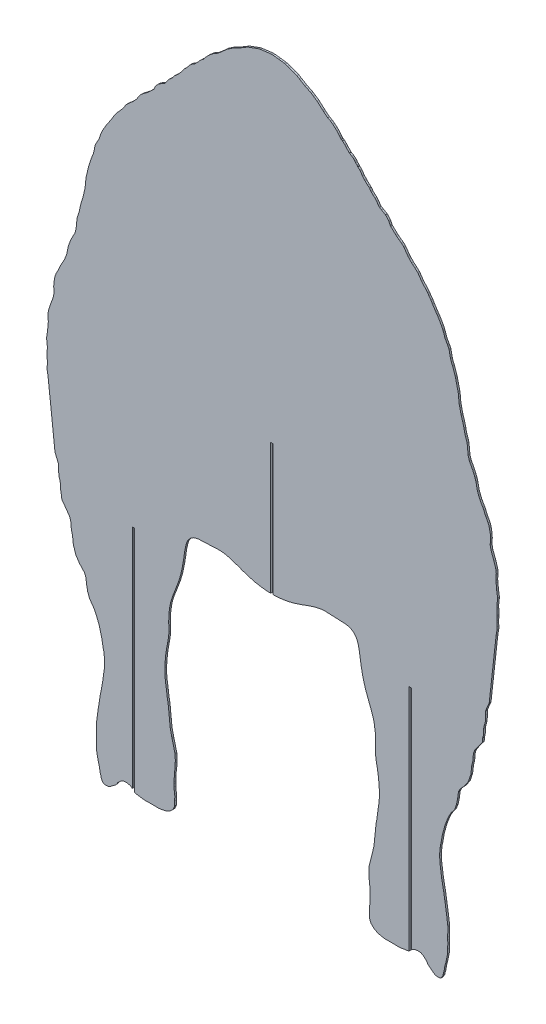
SolidWorks part; units mm, degrees
ref_plane "Спереди" through (0, 0, 0) normal (0, 0, 1) x (1, 0, 0)
ref_plane "Сверху" through (0, 0, 0) normal (0, 1, 0) x (1, 0, 0)
ref_plane "Справа" through (0, 0, 0) normal (1, 0, 0) x (0, 0, -1)
sketch "Model" plane through (0, 0, 0) normal (0, 0, 1) x (1, 0, 0)
  line L0 (-5496.2445, 189.9029) -> (-5495.9096, 189.4966)
  line L1 (-5495.9096, 189.4966) -> (-5494.3551, 186.1631)
  line L2 (-5494.3551, 186.1631) -> (-5493.4235, 179.621)
  line L3 (-5493.4235, 179.621) -> (-5493.4364, 179.0282)
  line L4 (-5493.4364, 179.0282) -> (-5492.0028, 172.1316)
  line L5 (-5492.0028, 172.1316) -> (-5491.8416, 171.8408)
  line L6 (-5491.8416, 171.8408) -> (-5491.6804, 171.5499)
  line L7 (-5491.6804, 171.5499) -> (-5490.0743, 166.7919)
  line L8 (-5490.0743, 166.7919) -> (-5489.6801, 166.2414)
  line L9 (-5489.6801, 166.2414) -> (-5489.4588, 165.9892)
  line L10 (-5489.4588, 165.9892) -> (-5489.2374, 165.737)
  line L11 (-5489.2374, 165.737) -> (-5486.8596, 162.5707)
  line L12 (-5486.8596, 162.5707) -> (-5486.5667, 162.237)
  line L13 (-5486.5667, 162.237) -> (-5486.2738, 161.9033)
  line L14 (-5486.2738, 161.9033) -> (-5484.7952, 159.28)
  line L15 (-5484.7952, 159.28) -> (-5483.6149, 157.1755)
  line L16 (-5483.6149, 157.1755) -> (-5481.8233, 152.959)
  line L17 (-5481.8233, 152.959) -> (-5481.7658, 152.7644)
  line L18 (-5481.7658, 152.7644) -> (-5481.7082, 152.5696)
  line L19 (-5481.7082, 152.5696) -> (-5480.7843, 150.3208)
  line L20 (-5480.7843, 150.3208) -> (-5480.0863, 148.4638)
  line L21 (-5480.0863, 148.4638) -> (-5479.4524, 147.0466)
  line L22 (-5479.4524, 147.0466) -> (-5479.2418, 146.1877)
  line L23 (-5479.2418, 146.1877) -> (-5476.2774, 135.1042)
  line L24 (-5476.2774, 135.1042) -> (-5474.7989, 126.6455)
  line L25 (-5474.7989, 126.6455) -> (-5474.1593, 124.0295)
  line L26 (-5474.1593, 124.0295) -> (-5473.7948, 121.4179)
  line L27 (-5473.7948, 121.4179) -> (-5473.392, 116.9064)
  line L28 (-5473.392, 116.9064) -> (-5473.1167, 113.4783)
  line L29 (-5473.1167, 113.4783) -> (-5473.4549, 109.7988)
  line L30 (-5473.4549, 109.7988) -> (-5473.5587, 106.9177)
  line L31 (-5473.5587, 106.9177) -> (-5474.4143, 100.9123)
  line L32 (-5474.4143, 100.9123) -> (-5475.4951, 92.9453)
  line L33 (-5475.4951, 92.9453) -> (-5476.1924, 89.4713)
  line L34 (-5476.1924, 89.4713) -> (-5477.0354, 84.4822)
  line L35 (-5477.0354, 84.4822) -> (-5477.8445, 80.8982)
  line L36 (-5477.8445, 80.8982) -> (-5479.0215, 73.1225)
  line L37 (-5479.0215, 73.1225) -> (-5479.2856, 71.7514)
  line L38 (-5479.2856, 71.7514) -> (-5480.7816, 62.0454)
  line L39 (-5480.7816, 62.0454) -> (-5482.3022, 50.7461)
  line L40 (-5482.3022, 50.7461) -> (-5482.335, 50.2573)
  line L41 (-5482.335, 50.2573) -> (-5482.3678, 49.7685)
  line L42 (-5482.3678, 49.7685) -> (-5482.3807, 48.9289)
  line L43 (-5482.3807, 48.9289) -> (-5482.2994, 39.0254)
  line L44 (-5482.2994, 39.0254) -> (-5482.2846, 36.1582)
  line L45 (-5482.2846, 36.1582) -> (-5482.418, 32.8984)
  line L46 (-5482.418, 32.8984) -> (-5482.1374, 27.2427)
  line L47 (-5482.1374, 27.2427) -> (-5482.1283, 22.9883)
  line L48 (-5482.1283, 22.9883) -> (-5480.2995, 14.143)
  line L49 (-5480.2995, 14.143) -> (-5480.0821, 13.1252)
  line L50 (-5480.0821, 13.1252) -> (-5480.0126, 12.9504)
  line L51 (-5480.0126, 12.9504) -> (-5479.943, 12.7754)
  line L52 (-5479.943, 12.7754) -> (-5479.8217, 12.2882)
  line L53 (-5479.8217, 12.2882) -> (-5479.7004, 11.801)
  line L54 (-5479.7004, 11.801) -> (-5478.7688, 8.2534)
  line L55 (-5478.7688, 8.2534) -> (-5478.5633, 5.9324)
  line L56 (-5478.5633, 5.9324) -> (-5478.0259, 3.5652)
  line L57 (-5478.0259, 3.5652) -> (-5477.6842, 2.6575)
  line L58 (-5477.6842, 2.6575) -> (-5477.1875, 0.3865)
  line L59 (-5477.1875, 0.3865) -> (-5476.9723, -0.7583)
  line L60 (-5476.9723, -0.7583) -> (-5475.4734, -3.2901)
  line L61 (-5475.4734, -3.2901) -> (-5475.135, -4.0174)
  line L62 (-5475.135, -4.0174) -> (-5474.6471, -4.3303)
  line L63 (-5474.6471, -4.3303) -> (-5472.6105, -5.0435)
  line L64 (-5472.6105, -5.0435) -> (-5470.0517, -4.833)
  line L65 (-5470.0517, -4.833) -> (-5468.8631, -4.739)
  line L66 (-5468.8631, -4.739) -> (-5467.9083, -4.3711)
  line L67 (-5467.9083, -4.3711) -> (-5464.1485, -1.6074)
  line L68 (-5464.1485, -1.6074) -> (-5460.7275, 1.0117)
  line L69 (-5460.7275, 1.0117) -> (-5460.0107, 1.8904)
  line L70 (-5460.0107, 1.8904) -> (-5458.4354, 4.2187)
  line L71 (-5458.4354, 4.2187) -> (-5458.1438, 4.6213)
  line L72 (-5458.1438, 4.6213) -> (-5454.8446, 7.6282)
  line L73 (-5454.8446, 7.6282) -> (-5453.4923, 8.2492)
  line L74 (-5453.4923, 8.2492) -> (-5452.1635, 8.935)
  line L75 (-5452.1635, 8.935) -> (-5449.5111, 9.2304)
  line L76 (-5449.5111, 9.2304) -> (-5449.0866, 9.2051)
  line L77 (-5449.0866, 9.2051) -> (-5448.6621, 9.1794)
  line L78 (-5448.6621, 9.1794) -> (-5448.5307, 9.1855)
  line L79 (-5448.5307, 9.1855) -> (-5448.3992, 9.1916)
  line L80 (-5448.3992, 9.1916) -> (-5447.2, 8.9678)
  line L81 (-5447.2, 8.9678) -> (-5445.5066, 8.6291)
  line L82 (-5445.5066, 8.6291) -> (-5444.0579, 8.3113)
  line L83 (-5444.0579, 8.3113) -> (-5442.2299, 6.7488)
  line L84 (-5442.2299, 6.7488) -> (-5442.2299, 260.5305)
  line L85 (-5442.2299, 260.5305) -> (-5441.9799, 260.5305)
  line L86 (-5441.9799, 260.5305) -> (-5439.9799, 260.5305)
  line L87 (-5439.9799, 260.5305) -> (-5439.7299, 260.5305)
  line L88 (-5439.7299, 260.5305) -> (-5439.7299, 4.612)
  line L89 (-5439.7299, 4.612) -> (-5438.7787, 3.7991)
  line L90 (-5438.7787, 3.7991) -> (-5434.6053, 3.1968)
  line L91 (-5434.6053, 3.1968) -> (-5430.5375, 2.5481)
  line L92 (-5430.5375, 2.5481) -> (-5427.125, 2.2878)
  line L93 (-5427.125, 2.2878) -> (-5418.6017, 2.4498)
  line L94 (-5418.6017, 2.4498) -> (-5418.4295, 2.4263)
  line L95 (-5418.4295, 2.4263) -> (-5418.2572, 2.4028)
  line L96 (-5418.2572, 2.4028) -> (-5418.0674, 2.3752)
  line L97 (-5418.0674, 2.3752) -> (-5417.8775, 2.3476)
  line L98 (-5417.8775, 2.3476) -> (-5414.0434, 2.4126)
  line L99 (-5414.0434, 2.4126) -> (-5413.2241, 2.2605)
  line L100 (-5413.2241, 2.2605) -> (-5409.9278, 2.5803)
  line L101 (-5409.9278, 2.5803) -> (-5404.4787, 3.842)
  line L102 (-5404.4787, 3.842) -> (-5404.2971, 3.862)
  line L103 (-5404.2971, 3.862) -> (-5404.1256, 3.9563)
  line L104 (-5404.1256, 3.9563) -> (-5403.9541, 4.0503)
  line L105 (-5403.9541, 4.0503) -> (-5400.4633, 5.7129)
  line L106 (-5400.4633, 5.7129) -> (-5399.5392, 6.4496)
  line L107 (-5399.5392, 6.4496) -> (-5396.795, 9.0265)
  line L108 (-5396.795, 9.0265) -> (-5396.635, 9.2409)
  line L109 (-5396.635, 9.2409) -> (-5396.475, 9.4553)
  line L110 (-5396.475, 9.4553) -> (-5395.3647, 11.9946)
  line L111 (-5395.3647, 11.9946) -> (-5394.8888, 13.2324)
  line L112 (-5394.8888, 13.2324) -> (-5394.7879, 18.3425)
  line L113 (-5394.7879, 18.3425) -> (-5394.5776, 22.6931)
  line L114 (-5394.5776, 22.6931) -> (-5394.7191, 24.8401)
  line L115 (-5394.7191, 24.8401) -> (-5395.2345, 28.1706)
  line L116 (-5395.2345, 28.1706) -> (-5395.3371, 31.6555)
  line L117 (-5395.3371, 31.6555) -> (-5395.4515, 34.6379)
  line L118 (-5395.4515, 34.6379) -> (-5395.3511, 36.647)
  line L119 (-5395.3511, 36.647) -> (-5395.2123, 40.7546)
  line L120 (-5395.2123, 40.7546) -> (-5395.0561, 42.5802)
  line L121 (-5395.0561, 42.5802) -> (-5395.03, 45.147)
  line L122 (-5395.03, 45.147) -> (-5394.4729, 49.5852)
  line L123 (-5394.4729, 49.5852) -> (-5394.1224, 55.52)
  line L124 (-5394.1224, 55.52) -> (-5394.0329, 58.1006)
  line L125 (-5394.0329, 58.1006) -> (-5394.3614, 63.8605)
  line L126 (-5394.3614, 63.8605) -> (-5394.4182, 64.4795)
  line L127 (-5394.4182, 64.4795) -> (-5394.5711, 65.0762)
  line L128 (-5394.5711, 65.0762) -> (-5397.6181, 77.3454)
  line L129 (-5397.6181, 77.3454) -> (-5397.8001, 77.905)
  line L130 (-5397.8001, 77.905) -> (-5398.0493, 79.0061)
  line L131 (-5398.0493, 79.0061) -> (-5399.6808, 86.3602)
  line L132 (-5399.6808, 86.3602) -> (-5400.5667, 94.6023)
  line L133 (-5400.5667, 94.6023) -> (-5401.1657, 100.3725)
  line L134 (-5401.1657, 100.3725) -> (-5401.7546, 106.4187)
  line L135 (-5401.7546, 106.4187) -> (-5402.2491, 110.143)
  line L136 (-5402.2491, 110.143) -> (-5403.0003, 114.0029)
  line L137 (-5403.0003, 114.0029) -> (-5403.9308, 121.3982)
  line L138 (-5403.9308, 121.3982) -> (-5405.2401, 130.3126)
  line L139 (-5405.2401, 130.3126) -> (-5405.2654, 130.8271)
  line L140 (-5405.2654, 130.8271) -> (-5405.7104, 135.5456)
  line L141 (-5405.7104, 135.5456) -> (-5405.7179, 141.811)
  line L142 (-5405.7179, 141.811) -> (-5405.6925, 143.3755)
  line L143 (-5405.6925, 143.3755) -> (-5405.4861, 147.0115)
  line L144 (-5405.4861, 147.0115) -> (-5404.7015, 155.7778)
  line L145 (-5404.7015, 155.7778) -> (-5404.2753, 158.4779)
  line L146 (-5404.2753, 158.4779) -> (-5403.5142, 163.4328)
  line L147 (-5403.5142, 163.4328) -> (-5403.4329, 163.742)
  line L148 (-5403.4329, 163.742) -> (-5402.5777, 168.0011)
  line L149 (-5402.5777, 168.0011) -> (-5402.4852, 168.4367)
  line L150 (-5402.4852, 168.4367) -> (-5401.8722, 172.4641)
  line L151 (-5401.8722, 172.4641) -> (-5401.2971, 177.0744)
  line L152 (-5401.2971, 177.0744) -> (-5401.243, 179.0469)
  line L153 (-5401.243, 179.0469) -> (-5401.3137, 184.6592)
  line L154 (-5401.3137, 184.6592) -> (-5401.4301, 188.1054)
  line L155 (-5401.4301, 188.1054) -> (-5401.225, 196.1673)
  line L156 (-5401.225, 196.1673) -> (-5401.1626, 197.2118)
  line L157 (-5401.1626, 197.2118) -> (-5400.453, 202.1882)
  line L158 (-5400.453, 202.1882) -> (-5400.1592, 204.4477)
  line L159 (-5400.1592, 204.4477) -> (-5400.0922, 204.7002)
  line L160 (-5400.0922, 204.7002) -> (-5399.1198, 209.3453)
  line L161 (-5399.1198, 209.3453) -> (-5396.9029, 216.0772)
  line L162 (-5396.9029, 216.0772) -> (-5396.5681, 217.073)
  line L163 (-5396.5681, 217.073) -> (-5395.5662, 219.4718)
  line L164 (-5395.5662, 219.4718) -> (-5393.1942, 225.6994)
  line L165 (-5393.1942, 225.6994) -> (-5390.6319, 232.5133)
  line L166 (-5390.6319, 232.5133) -> (-5389.0655, 237.5125)
  line L167 (-5389.0655, 237.5125) -> (-5387.8519, 241.9003)
  line L168 (-5387.8519, 241.9003) -> (-5386.7918, 246.574)
  line L169 (-5386.7918, 246.574) -> (-5385.8331, 251.2091)
  line L170 (-5385.8331, 251.2091) -> (-5385.298, 254.2684)
  line L171 (-5385.298, 254.2684) -> (-5384.5135, 259.1114)
  line L172 (-5384.5135, 259.1114) -> (-5383.836, 263.798)
  line L173 (-5383.836, 263.798) -> (-5383.3877, 266.9922)
  line L174 (-5383.3877, 266.9922) -> (-5382.6923, 270.2218)
  line L175 (-5382.6923, 270.2218) -> (-5382.0459, 273.2052)
  line L176 (-5382.0459, 273.2052) -> (-5381.0132, 276.1477)
  line L177 (-5381.0132, 276.1477) -> (-5380.199, 277.9815)
  line L178 (-5380.199, 277.9815) -> (-5379.4204, 279.1903)
  line L179 (-5379.4204, 279.1903) -> (-5378.6526, 280.029)
  line L180 (-5378.6526, 280.029) -> (-5377.137, 282.0069)
  line L181 (-5377.137, 282.0069) -> (-5375.0265, 283.3319)
  line L182 (-5375.0265, 283.3319) -> (-5374.0647, 283.9898)
  line L183 (-5374.0647, 283.9898) -> (-5372.4247, 284.6144)
  line L184 (-5372.4247, 284.6144) -> (-5369.9607, 285.2689)
  line L185 (-5369.9607, 285.2689) -> (-5368.4474, 285.6445)
  line L186 (-5368.4474, 285.6445) -> (-5344.728, 286.6764)
  line L187 (-5344.728, 286.6764) -> (-5340.5729, 286.369)
  line L188 (-5340.5729, 286.369) -> (-5340.4043, 286.373)
  line L189 (-5340.4043, 286.373) -> (-5340.0835, 286.36)
  line L190 (-5340.0835, 286.36) -> (-5339.2209, 286.1743)
  line L191 (-5339.2209, 286.1743) -> (-5333.6626, 285.0128)
  line L192 (-5333.6626, 285.0128) -> (-5329.7618, 283.6271)
  line L193 (-5329.7618, 283.6271) -> (-5327.3638, 282.9614)
  line L194 (-5327.3638, 282.9614) -> (-5323.4804, 281.5655)
  line L195 (-5323.4804, 281.5655) -> (-5320.6819, 280.5334)
  line L196 (-5320.6819, 280.5334) -> (-5318.4154, 279.6736)
  line L197 (-5318.4154, 279.6736) -> (-5312.1751, 277.628)
  line L198 (-5312.1751, 277.628) -> (-5306.9514, 276.1664)
  line L199 (-5306.9514, 276.1664) -> (-5304.8312, 275.614)
  line L200 (-5304.8312, 275.614) -> (-5303.2028, 275.3152)
  line L201 (-5303.2028, 275.3152) -> (-5298.5116, 274.4743)
  line L202 (-5298.5116, 274.4743) -> (-5296.5531, 274.2131)
  line L203 (-5296.5531, 274.2131) -> (-5291.688, 273.7102)
  line L204 (-5291.688, 273.7102) -> (-5289.2627, 273.5881)
  line L205 (-5289.2627, 273.5881) -> (-5287.2298, 273.546)
  line L206 (-5287.2298, 273.546) -> (-5287.2298, 419.877)
  line L207 (-5287.2298, 419.877) -> (-5286.9799, 419.877)
  line L208 (-5286.9799, 419.877) -> (-5284.9799, 419.877)
  line L209 (-5284.9799, 419.877) -> (-5284.7298, 419.877)
  line L210 (-5284.7298, 419.877) -> (-5284.7298, 273.5372)
  line L211 (-5284.7298, 273.5372) -> (-5282.8709, 273.5877)
  line L212 (-5282.8709, 273.5877) -> (-5281.9771, 273.6062)
  line L213 (-5281.9771, 273.6062) -> (-5279.5518, 273.7285)
  line L214 (-5279.5518, 273.7285) -> (-5274.6867, 274.2312)
  line L215 (-5274.6867, 274.2312) -> (-5272.7281, 274.4925)
  line L216 (-5272.7281, 274.4925) -> (-5268.0369, 275.3334)
  line L217 (-5268.0369, 275.3334) -> (-5266.4085, 275.6322)
  line L218 (-5266.4085, 275.6322) -> (-5264.2884, 276.1846)
  line L219 (-5264.2884, 276.1846) -> (-5259.0647, 277.6462)
  line L220 (-5259.0647, 277.6462) -> (-5252.8244, 279.6919)
  line L221 (-5252.8244, 279.6919) -> (-5250.5579, 280.5516)
  line L222 (-5250.5579, 280.5516) -> (-5247.7593, 281.5837)
  line L223 (-5247.7593, 281.5837) -> (-5243.876, 282.9797)
  line L224 (-5243.876, 282.9797) -> (-5241.4779, 283.6453)
  line L225 (-5241.4779, 283.6453) -> (-5237.5772, 285.0309)
  line L226 (-5237.5772, 285.0309) -> (-5232.0188, 286.1925)
  line L227 (-5232.0188, 286.1925) -> (-5231.1563, 286.3782)
  line L228 (-5231.1563, 286.3782) -> (-5230.8354, 286.3912)
  line L229 (-5230.8354, 286.3912) -> (-5230.6669, 286.3872)
  line L230 (-5230.6669, 286.3872) -> (-5226.5118, 286.6946)
  line L231 (-5226.5118, 286.6946) -> (-5202.7923, 285.6626)
  line L232 (-5202.7923, 285.6626) -> (-5201.2791, 285.2871)
  line L233 (-5201.2791, 285.2871) -> (-5198.8151, 284.6326)
  line L234 (-5198.8151, 284.6326) -> (-5197.175, 284.0081)
  line L235 (-5197.175, 284.0081) -> (-5196.2132, 283.3501)
  line L236 (-5196.2132, 283.3501) -> (-5194.1028, 282.0251)
  line L237 (-5194.1028, 282.0251) -> (-5192.5872, 280.0472)
  line L238 (-5192.5872, 280.0472) -> (-5191.8194, 279.2085)
  line L239 (-5191.8194, 279.2085) -> (-5191.0408, 277.9997)
  line L240 (-5191.0408, 277.9997) -> (-5190.2266, 276.1659)
  line L241 (-5190.2266, 276.1659) -> (-5189.1939, 273.2234)
  line L242 (-5189.1939, 273.2234) -> (-5188.5475, 270.24)
  line L243 (-5188.5475, 270.24) -> (-5187.8521, 267.0104)
  line L244 (-5187.8521, 267.0104) -> (-5187.4037, 263.8162)
  line L245 (-5187.4037, 263.8162) -> (-5186.7264, 259.1296)
  line L246 (-5186.7264, 259.1296) -> (-5185.9418, 254.2866)
  line L247 (-5185.9418, 254.2866) -> (-5185.4066, 251.2273)
  line L248 (-5185.4066, 251.2273) -> (-5184.4479, 246.5922)
  line L249 (-5184.4479, 246.5922) -> (-5183.3879, 241.9185)
  line L250 (-5183.3879, 241.9185) -> (-5182.1742, 237.5307)
  line L251 (-5182.1742, 237.5307) -> (-5180.6079, 232.5315)
  line L252 (-5180.6079, 232.5315) -> (-5178.0456, 225.7177)
  line L253 (-5178.0456, 225.7177) -> (-5175.6736, 219.4901)
  line L254 (-5175.6736, 219.4901) -> (-5174.6717, 217.0913)
  line L255 (-5174.6717, 217.0913) -> (-5174.3368, 216.0954)
  line L256 (-5174.3368, 216.0954) -> (-5172.1199, 209.3635)
  line L257 (-5172.1199, 209.3635) -> (-5171.1476, 204.7184)
  line L258 (-5171.1476, 204.7184) -> (-5171.0806, 204.4659)
  line L259 (-5171.0806, 204.4659) -> (-5170.7867, 202.2064)
  line L260 (-5170.7867, 202.2064) -> (-5170.0772, 197.23)
  line L261 (-5170.0772, 197.23) -> (-5170.0147, 196.1855)
  line L262 (-5170.0147, 196.1855) -> (-5169.8097, 188.1236)
  line L263 (-5169.8097, 188.1236) -> (-5169.9261, 184.6773)
  line L264 (-5169.9261, 184.6773) -> (-5169.9967, 179.0652)
  line L265 (-5169.9967, 179.0652) -> (-5169.9427, 177.0925)
  line L266 (-5169.9427, 177.0925) -> (-5169.3676, 172.4823)
  line L267 (-5169.3676, 172.4823) -> (-5168.7545, 168.4551)
  line L268 (-5168.7545, 168.4551) -> (-5168.662, 168.0193)
  line L269 (-5168.662, 168.0193) -> (-5167.8069, 163.7602)
  line L270 (-5167.8069, 163.7602) -> (-5167.7256, 163.4512)
  line L271 (-5167.7256, 163.4512) -> (-5166.9645, 158.4961)
  line L272 (-5166.9645, 158.4961) -> (-5166.5382, 155.7961)
  line L273 (-5166.5382, 155.7961) -> (-5165.7537, 147.0295)
  line L274 (-5165.7537, 147.0295) -> (-5165.5473, 143.3938)
  line L275 (-5165.5473, 143.3938) -> (-5165.5218, 141.8293)
  line L276 (-5165.5218, 141.8293) -> (-5165.5295, 135.5639)
  line L277 (-5165.5295, 135.5639) -> (-5165.9743, 130.8452)
  line L278 (-5165.9743, 130.8452) -> (-5165.9997, 130.3308)
  line L279 (-5165.9997, 130.3308) -> (-5167.309, 121.4165)
  line L280 (-5167.309, 121.4165) -> (-5168.2394, 114.021)
  line L281 (-5168.2394, 114.021) -> (-5168.9906, 110.1614)
  line L282 (-5168.9906, 110.1614) -> (-5169.4851, 106.437)
  line L283 (-5169.4851, 106.437) -> (-5170.074, 100.3909)
  line L284 (-5170.074, 100.3909) -> (-5170.673, 94.6205)
  line L285 (-5170.673, 94.6205) -> (-5171.5589, 86.3784)
  line L286 (-5171.5589, 86.3784) -> (-5173.1905, 79.0244)
  line L287 (-5173.1905, 79.0244) -> (-5173.4397, 77.9232)
  line L288 (-5173.4397, 77.9232) -> (-5173.6216, 77.3635)
  line L289 (-5173.6216, 77.3635) -> (-5176.6686, 65.0942)
  line L290 (-5176.6686, 65.0942) -> (-5176.8216, 64.4978)
  line L291 (-5176.8216, 64.4978) -> (-5176.8785, 63.8786)
  line L292 (-5176.8785, 63.8786) -> (-5177.2069, 58.1186)
  line L293 (-5177.2069, 58.1186) -> (-5177.1173, 55.5381)
  line L294 (-5177.1173, 55.5381) -> (-5176.7669, 49.6035)
  line L295 (-5176.7669, 49.6035) -> (-5176.2097, 45.1653)
  line L296 (-5176.2097, 45.1653) -> (-5176.1837, 42.5984)
  line L297 (-5176.1837, 42.5984) -> (-5176.0275, 40.7729)
  line L298 (-5176.0275, 40.7729) -> (-5175.8887, 36.6653)
  line L299 (-5175.8887, 36.6653) -> (-5175.7882, 34.6562)
  line L300 (-5175.7882, 34.6562) -> (-5175.9026, 31.6738)
  line L301 (-5175.9026, 31.6738) -> (-5176.0053, 28.1887)
  line L302 (-5176.0053, 28.1887) -> (-5176.5207, 24.8584)
  line L303 (-5176.5207, 24.8584) -> (-5176.6621, 22.7112)
  line L304 (-5176.6621, 22.7112) -> (-5176.4518, 18.3606)
  line L305 (-5176.4518, 18.3606) -> (-5176.351, 13.2507)
  line L306 (-5176.351, 13.2507) -> (-5175.8752, 12.0129)
  line L307 (-5175.8752, 12.0129) -> (-5174.7648, 9.4736)
  line L308 (-5174.7648, 9.4736) -> (-5174.6048, 9.259)
  line L309 (-5174.6048, 9.259) -> (-5174.4447, 9.0447)
  line L310 (-5174.4447, 9.0447) -> (-5171.7006, 6.4678)
  line L311 (-5171.7006, 6.4678) -> (-5170.7764, 5.7309)
  line L312 (-5170.7764, 5.7309) -> (-5167.2857, 4.0686)
  line L313 (-5167.2857, 4.0686) -> (-5166.9427, 3.8804)
  line L314 (-5166.9427, 3.8804) -> (-5166.761, 3.8603)
  line L315 (-5166.761, 3.8603) -> (-5161.3119, 2.5984)
  line L316 (-5161.3119, 2.5984) -> (-5158.0157, 2.2788)
  line L317 (-5158.0157, 2.2788) -> (-5157.1963, 2.4309)
  line L318 (-5157.1963, 2.4309) -> (-5153.3622, 2.3658)
  line L319 (-5153.3622, 2.3658) -> (-5153.1724, 2.3935)
  line L320 (-5153.1724, 2.3935) -> (-5152.9826, 2.4211)
  line L321 (-5152.9826, 2.4211) -> (-5152.638, 2.468)
  line L322 (-5152.638, 2.468) -> (-5144.1148, 2.3059)
  line L323 (-5144.1148, 2.3059) -> (-5140.7022, 2.5663)
  line L324 (-5140.7022, 2.5663) -> (-5136.6344, 3.2151)
  line L325 (-5136.6344, 3.2151) -> (-5132.4611, 3.8174)
  line L326 (-5132.4611, 3.8174) -> (-5132.2299, 4.0149)
  line L327 (-5132.2299, 4.0149) -> (-5132.2299, 260.5305)
  line L328 (-5132.2299, 260.5305) -> (-5131.9799, 260.5305)
  line L329 (-5131.9799, 260.5305) -> (-5129.9799, 260.5305)
  line L330 (-5129.9799, 260.5305) -> (-5129.7299, 260.5305)
  line L331 (-5129.7299, 260.5305) -> (-5129.7299, 6.1517)
  line L332 (-5129.7299, 6.1517) -> (-5127.1819, 8.3293)
  line L333 (-5127.1819, 8.3293) -> (-5125.7344, 8.6472)
  line L334 (-5125.7344, 8.6472) -> (-5124.0347, 8.9868)
  line L335 (-5124.0347, 8.9868) -> (-5122.8405, 9.2099)
  line L336 (-5122.8405, 9.2099) -> (-5122.5777, 9.1977)
  line L337 (-5122.5777, 9.1977) -> (-5121.7287, 9.2488)
  line L338 (-5121.7287, 9.2488) -> (-5119.0762, 8.9534)
  line L339 (-5119.0762, 8.9534) -> (-5117.7473, 8.2676)
  line L340 (-5117.7473, 8.2676) -> (-5116.3952, 7.6462)
  line L341 (-5116.3952, 7.6462) -> (-5113.096, 4.6394)
  line L342 (-5113.096, 4.6394) -> (-5112.8044, 4.237)
  line L343 (-5112.8044, 4.237) -> (-5111.229, 1.9087)
  line L344 (-5111.229, 1.9087) -> (-5110.5122, 1.0298)
  line L345 (-5110.5122, 1.0298) -> (-5107.0912, -1.5894)
  line L346 (-5107.0912, -1.5894) -> (-5103.3315, -4.3528)
  line L347 (-5103.3315, -4.3528) -> (-5102.3766, -4.721)
  line L348 (-5102.3766, -4.721) -> (-5101.188, -4.8147)
  line L349 (-5101.188, -4.8147) -> (-5098.6293, -5.0254)
  line L350 (-5098.6293, -5.0254) -> (-5096.5927, -4.312)
  line L351 (-5096.5927, -4.312) -> (-5096.1046, -3.9993)
  line L352 (-5096.1046, -3.9993) -> (-5095.7663, -3.2717)
  line L353 (-5095.7663, -3.2717) -> (-5094.2674, -0.7403)
  line L354 (-5094.2674, -0.7403) -> (-5094.0522, 0.4048)
  line L355 (-5094.0522, 0.4048) -> (-5093.5555, 2.6755)
  line L356 (-5093.5555, 2.6755) -> (-5093.2138, 3.5832)
  line L357 (-5093.2138, 3.5832) -> (-5092.6764, 5.9504)
  line L358 (-5092.6764, 5.9504) -> (-5092.471, 8.2715)
  line L359 (-5092.471, 8.2715) -> (-5091.5393, 11.8191)
  line L360 (-5091.5393, 11.8191) -> (-5091.2967, 12.7937)
  line L361 (-5091.2967, 12.7937) -> (-5091.1576, 13.1435)
  line L362 (-5091.1576, 13.1435) -> (-5090.9402, 14.1611)
  line L363 (-5090.9402, 14.1611) -> (-5089.1114, 23.0066)
  line L364 (-5089.1114, 23.0066) -> (-5089.1023, 27.2607)
  line L365 (-5089.1023, 27.2607) -> (-5088.8218, 32.9165)
  line L366 (-5088.8218, 32.9165) -> (-5088.9552, 36.1765)
  line L367 (-5088.9552, 36.1765) -> (-5088.9403, 39.0437)
  line L368 (-5088.9403, 39.0437) -> (-5088.859, 48.947)
  line L369 (-5088.859, 48.947) -> (-5088.8721, 49.7868)
  line L370 (-5088.8721, 49.7868) -> (-5088.9377, 50.7641)
  line L371 (-5088.9377, 50.7641) -> (-5090.458, 62.0635)
  line L372 (-5090.458, 62.0635) -> (-5091.9541, 71.7698)
  line L373 (-5091.9541, 71.7698) -> (-5092.2182, 73.1406)
  line L374 (-5092.2182, 73.1406) -> (-5093.3952, 80.9165)
  line L375 (-5093.3952, 80.9165) -> (-5094.2044, 84.5005)
  line L376 (-5094.2044, 84.5005) -> (-5095.0473, 89.4895)
  line L377 (-5095.0473, 89.4895) -> (-5095.7445, 92.9636)
  line L378 (-5095.7445, 92.9636) -> (-5096.8254, 100.9306)
  line L379 (-5096.8254, 100.9306) -> (-5097.6811, 106.9358)
  line L380 (-5097.6811, 106.9358) -> (-5097.7848, 109.8169)
  line L381 (-5097.7848, 109.8169) -> (-5098.1231, 113.4963)
  line L382 (-5098.1231, 113.4963) -> (-5097.8477, 116.9245)
  line L383 (-5097.8477, 116.9245) -> (-5097.445, 121.4363)
  line L384 (-5097.445, 121.4363) -> (-5097.0805, 124.0478)
  line L385 (-5097.0805, 124.0478) -> (-5096.4408, 126.6636)
  line L386 (-5096.4408, 126.6636) -> (-5094.9624, 135.1223)
  line L387 (-5094.9624, 135.1223) -> (-5091.998, 146.206)
  line L388 (-5091.998, 146.206) -> (-5091.7874, 147.0647)
  line L389 (-5091.7874, 147.0647) -> (-5091.1535, 148.4822)
  line L390 (-5091.1535, 148.4822) -> (-5090.4555, 150.3388)
  line L391 (-5090.4555, 150.3388) -> (-5089.5315, 152.5879)
  line L392 (-5089.5315, 152.5879) -> (-5089.4164, 152.9773)
  line L393 (-5089.4164, 152.9773) -> (-5087.6248, 157.1936)
  line L394 (-5087.6248, 157.1936) -> (-5086.4446, 159.2981)
  line L395 (-5086.4446, 159.2981) -> (-5084.966, 161.9214)
  line L396 (-5084.966, 161.9214) -> (-5084.3802, 162.5888)
  line L397 (-5084.3802, 162.5888) -> (-5082.0024, 165.7552)
  line L398 (-5082.0024, 165.7552) -> (-5081.5597, 166.2596)
  line L399 (-5081.5597, 166.2596) -> (-5081.1654, 166.81)
  line L400 (-5081.1654, 166.81) -> (-5079.5594, 171.5681)
  line L401 (-5079.5594, 171.5681) -> (-5079.2368, 172.1498)
  line L402 (-5079.2368, 172.1498) -> (-5077.8033, 179.0464)
  line L403 (-5077.8033, 179.0464) -> (-5077.8162, 179.6391)
  line L404 (-5077.8162, 179.6391) -> (-5076.8756, 186.2084)
  line L405 (-5076.8756, 186.2084) -> (-5075.3302, 189.5149)
  line L406 (-5075.3302, 189.5149) -> (-5074.9953, 189.9211)
  line L407 (-5074.9953, 189.9211) -> (-5070.2549, 195.0317)
  line L408 (-5070.2549, 195.0317) -> (-5067.4744, 199.1148)
  line L409 (-5067.4744, 199.1148) -> (-5066.7221, 200.2868)
  line L410 (-5066.7221, 200.2868) -> (-5066.3842, 200.7108)
  line L411 (-5066.3842, 200.7108) -> (-5065.743, 201.8237)
  line L412 (-5065.743, 201.8237) -> (-5064.6653, 205.0553)
  line L413 (-5064.6653, 205.0553) -> (-5063.9584, 207.6759)
  line L414 (-5063.9584, 207.6759) -> (-5063.1443, 209.5178)
  line L415 (-5063.1443, 209.5178) -> (-5062.1922, 217.4028)
  line L416 (-5062.1922, 217.4028) -> (-5062.0937, 218.5948)
  line L417 (-5062.0937, 218.5948) -> (-5060.8835, 223.4414)
  line L418 (-5060.8835, 223.4414) -> (-5060.4403, 227.1481)
  line L419 (-5060.4403, 227.1481) -> (-5060.3356, 229.7598)
  line L420 (-5060.3356, 229.7598) -> (-5059.9777, 231.8676)
  line L421 (-5059.9777, 231.8676) -> (-5059.8001, 232.7123)
  line L422 (-5059.8001, 232.7123) -> (-5058.6982, 235.6195)
  line L423 (-5058.6982, 235.6195) -> (-5057.3608, 237.4139)
  line L424 (-5057.3608, 237.4139) -> (-5055.286, 240.6368)
  line L425 (-5055.286, 240.6368) -> (-5051.8067, 245.2318)
  line L426 (-5051.8067, 245.2318) -> (-5050.4565, 246.9567)
  line L427 (-5050.4565, 246.9567) -> (-5050.1734, 247.4129)
  line L428 (-5050.1734, 247.4129) -> (-5049.8714, 249.5642)
  line L429 (-5049.8714, 249.5642) -> (-5050.0432, 251.3419)
  line L430 (-5050.0432, 251.3419) -> (-5049.3152, 253.1749)
  line L431 (-5049.3152, 253.1749) -> (-5048.9193, 255.3772)
  line L432 (-5048.9193, 255.3772) -> (-5048.638, 261.0132)
  line L433 (-5048.638, 261.0132) -> (-5048.6415, 261.8511)
  line L434 (-5048.6415, 261.8511) -> (-5048.1311, 264.2715)
  line L435 (-5048.1311, 264.2715) -> (-5046.8805, 268.9176)
  line L436 (-5046.8805, 268.9176) -> (-5046.7858, 269.6905)
  line L437 (-5046.7858, 269.6905) -> (-5046.7941, 270.0367)
  line L438 (-5046.7941, 270.0367) -> (-5046.3373, 276.3331)
  line L439 (-5046.3373, 276.3331) -> (-5046.6477, 279.1266)
  line L440 (-5046.6477, 279.1266) -> (-5046.5723, 279.8292)
  line L441 (-5046.5723, 279.8292) -> (-5043.2648, 287.8219)
  line L442 (-5043.2648, 287.8219) -> (-5042.8571, 288.6746)
  line L443 (-5042.8571, 288.6746) -> (-5042.523, 289.2183)
  line L444 (-5042.523, 289.2183) -> (-5034.7941, 358.4404)
  line L445 (-5034.7941, 358.4404) -> (-5033.9411, 363.7396)
  line L446 (-5033.9411, 363.7396) -> (-5033.7005, 364.9829)
  line L447 (-5033.7005, 364.9829) -> (-5033.6393, 367.796)
  line L448 (-5033.6393, 367.796) -> (-5034.0251, 371.3267)
  line L449 (-5034.0251, 371.3267) -> (-5034.0122, 373.0443)
  line L450 (-5034.0122, 373.0443) -> (-5033.5434, 377.2124)
  line L451 (-5033.5434, 377.2124) -> (-5033.4755, 378.4899)
  line L452 (-5033.4755, 378.4899) -> (-5033.543, 378.9758)
  line L453 (-5033.543, 378.9758) -> (-5033.7709, 384.7782)
  line L454 (-5033.7709, 384.7782) -> (-5033.8905, 385.6756)
  line L455 (-5033.8905, 385.6756) -> (-5033.835, 388.5327)
  line L456 (-5033.835, 388.5327) -> (-5033.0426, 395.6138)
  line L457 (-5033.0426, 395.6138) -> (-5033.0308, 395.8)
  line L458 (-5033.0308, 395.8) -> (-5033.0113, 395.9221)
  line L459 (-5033.0113, 395.9221) -> (-5034.0009, 402.2862)
  line L460 (-5034.0009, 402.2862) -> (-5034.1834, 403.6155)
  line L461 (-5034.1834, 403.6155) -> (-5034.7428, 409.8151)
  line L462 (-5034.7428, 409.8151) -> (-5034.9175, 411.6043)
  line L463 (-5034.9175, 411.6043) -> (-5035.0041, 412.3087)
  line L464 (-5035.0041, 412.3087) -> (-5034.69, 417.1799)
  line L465 (-5034.69, 417.1799) -> (-5034.5666, 418.7158)
  line L466 (-5034.5666, 418.7158) -> (-5034.8029, 421.4727)
  line L467 (-5034.8029, 421.4727) -> (-5035.1881, 423.4365)
  line L468 (-5035.1881, 423.4365) -> (-5037.1684, 429.8677)
  line L469 (-5037.1684, 429.8677) -> (-5040.4348, 438.5483)
  line L470 (-5040.4348, 438.5483) -> (-5041.3296, 443.1146)
  line L471 (-5041.3296, 443.1146) -> (-5041.3691, 443.3788)
  line L472 (-5041.3691, 443.3788) -> (-5041.3267, 444.4403)
  line L473 (-5041.3267, 444.4403) -> (-5041.2123, 445.7647)
  line L474 (-5041.2123, 445.7647) -> (-5041.05, 449.1643)
  line L475 (-5041.05, 449.1643) -> (-5041.0439, 449.8028)
  line L476 (-5041.0439, 449.8028) -> (-5041.2307, 453.8414)
  line L477 (-5041.2307, 453.8414) -> (-5042.2644, 459.2745)
  line L478 (-5042.2644, 459.2745) -> (-5042.581, 460.5488)
  line L479 (-5042.581, 460.5488) -> (-5043.7065, 463.6885)
  line L480 (-5043.7065, 463.6885) -> (-5045.5797, 467.0448)
  line L481 (-5045.5797, 467.0448) -> (-5046.3013, 468.5767)
  line L482 (-5046.3013, 468.5767) -> (-5046.8667, 469.5445)
  line L483 (-5046.8667, 469.5445) -> (-5048.4388, 473.2829)
  line L484 (-5048.4388, 473.2829) -> (-5049.5841, 475.5612)
  line L485 (-5049.5841, 475.5612) -> (-5052.7362, 481.0906)
  line L486 (-5052.7362, 481.0906) -> (-5054.006, 484.0773)
  line L487 (-5054.006, 484.0773) -> (-5054.4533, 485.3843)
  line L488 (-5054.4533, 485.3843) -> (-5055.4709, 487.8962)
  line L489 (-5055.4709, 487.8962) -> (-5055.7193, 488.7455)
  line L490 (-5055.7193, 488.7455) -> (-5057.2304, 496.1335)
  line L491 (-5057.2304, 496.1335) -> (-5057.4883, 497.1829)
  line L492 (-5057.4883, 497.1829) -> (-5058.148, 499.1667)
  line L493 (-5058.148, 499.1667) -> (-5058.4252, 500.0277)
  line L494 (-5058.4252, 500.0277) -> (-5058.4688, 500.1317)
  line L495 (-5058.4688, 500.1317) -> (-5058.5653, 500.4221)
  line L496 (-5058.5653, 500.4221) -> (-5059.5772, 502.834)
  line L497 (-5059.5772, 502.834) -> (-5060.9157, 506.0546)
  line L498 (-5060.9157, 506.0546) -> (-5064.0276, 511.9442)
  line L499 (-5064.0276, 511.9442) -> (-5064.5601, 512.9406)
  line L500 (-5064.5601, 512.9406) -> (-5064.8484, 513.6022)
  line L501 (-5064.8484, 513.6022) -> (-5065.2777, 515.0453)
  line L502 (-5065.2777, 515.0453) -> (-5066.0171, 517.7166)
  line L503 (-5066.0171, 517.7166) -> (-5066.0555, 517.9199)
  line L504 (-5066.0555, 517.9199) -> (-5066.1033, 518.3999)
  line L505 (-5066.1033, 518.3999) -> (-5067.2262, 529.1884)
  line L506 (-5067.2262, 529.1884) -> (-5067.9337, 531.5906)
  line L507 (-5067.9337, 531.5906) -> (-5068.857, 534.2577)
  line L508 (-5068.857, 534.2577) -> (-5069.5998, 536.4085)
  line L509 (-5069.5998, 536.4085) -> (-5070.4163, 540.1633)
  line L510 (-5070.4163, 540.1633) -> (-5070.6985, 541.5399)
  line L511 (-5070.6985, 541.5399) -> (-5070.7475, 541.9412)
  line L512 (-5070.7475, 541.9412) -> (-5072.1618, 547.3559)
  line L513 (-5072.1618, 547.3559) -> (-5073.7014, 552.4192)
  line L514 (-5073.7014, 552.4192) -> (-5073.897, 553.0191)
  line L515 (-5073.897, 553.0191) -> (-5074.1014, 553.6592)
  line L516 (-5074.1014, 553.6592) -> (-5075.2986, 559.0795)
  line L517 (-5075.2986, 559.0795) -> (-5075.61, 560.6137)
  line L518 (-5075.61, 560.6137) -> (-5076.1664, 562.4688)
  line L519 (-5076.1664, 562.4688) -> (-5076.7587, 568.8933)
  line L520 (-5076.7587, 568.8933) -> (-5077.0398, 572.0284)
  line L521 (-5077.0398, 572.0284) -> (-5077.3553, 573.8033)
  line L522 (-5077.3553, 573.8033) -> (-5079.0506, 581.0061)
  line L523 (-5079.0506, 581.0061) -> (-5080.0185, 585.034)
  line L524 (-5080.0185, 585.034) -> (-5080.0987, 585.2922)
  line L525 (-5080.0987, 585.2922) -> (-5080.3587, 586.4795)
  line L526 (-5080.3587, 586.4795) -> (-5080.7127, 587.6883)
  line L527 (-5080.7127, 587.6883) -> (-5083.3742, 595.59)
  line L528 (-5083.3742, 595.59) -> (-5083.5474, 595.9801)
  line L529 (-5083.5474, 595.9801) -> (-5083.6137, 596.1753)
  line L530 (-5083.6137, 596.1753) -> (-5084.9306, 599.1236)
  line L531 (-5084.9306, 599.1236) -> (-5085.699, 601.4732)
  line L532 (-5085.699, 601.4732) -> (-5085.8715, 602.2506)
  line L533 (-5085.8715, 602.2506) -> (-5086.5213, 605.3258)
  line L534 (-5086.5213, 605.3258) -> (-5087.335, 609.4992)
  line L535 (-5087.335, 609.4992) -> (-5087.3872, 609.7352)
  line L536 (-5087.3872, 609.7352) -> (-5087.6238, 610.4343)
  line L537 (-5087.6238, 610.4343) -> (-5088.5968, 612.3618)
  line L538 (-5088.5968, 612.3618) -> (-5089.0039, 613.0687)
  line L539 (-5089.0039, 613.0687) -> (-5089.5419, 614.1323)
  line L540 (-5089.5419, 614.1323) -> (-5090.6342, 616.0877)
  line L541 (-5090.6342, 616.0877) -> (-5091.3391, 617.3135)
  line L542 (-5091.3391, 617.3135) -> (-5091.8114, 618.2608)
  line L543 (-5091.8114, 618.2608) -> (-5092.3152, 619.4171)
  line L544 (-5092.3152, 619.4171) -> (-5092.7061, 620.5995)
  line L545 (-5092.7061, 620.5995) -> (-5092.9919, 621.5558)
  line L546 (-5092.9919, 621.5558) -> (-5093.3745, 622.6217)
  line L547 (-5093.3745, 622.6217) -> (-5093.751, 623.7605)
  line L548 (-5093.751, 623.7605) -> (-5093.9125, 624.1204)
  line L549 (-5093.9125, 624.1204) -> (-5094.1559, 624.7987)
  line L550 (-5094.1559, 624.7987) -> (-5094.5435, 625.6594)
  line L551 (-5094.5435, 625.6594) -> (-5095.9634, 628.8488)
  line L552 (-5095.9634, 628.8488) -> (-5099.9745, 635.5974)
  line L553 (-5099.9745, 635.5974) -> (-5100.6933, 636.7075)
  line L554 (-5100.6933, 636.7075) -> (-5100.8407, 636.9388)
  line L555 (-5100.8407, 636.9388) -> (-5101.3076, 637.5334)
  line L556 (-5101.3076, 637.5334) -> (-5102.372, 639.1269)
  line L557 (-5102.372, 639.1269) -> (-5103.0606, 640.1999)
  line L558 (-5103.0606, 640.1999) -> (-5105.9508, 644.5805)
  line L559 (-5105.9508, 644.5805) -> (-5107.8858, 647.8319)
  line L560 (-5107.8858, 647.8319) -> (-5109.8957, 650.6239)
  line L561 (-5109.8957, 650.6239) -> (-5110.5078, 651.4879)
  line L562 (-5110.5078, 651.4879) -> (-5111.3583, 652.7647)
  line L563 (-5111.3583, 652.7647) -> (-5112.0617, 653.7685)
  line L564 (-5112.0617, 653.7685) -> (-5113.1313, 654.8969)
  line L565 (-5113.1313, 654.8969) -> (-5118.2248, 660.6872)
  line L566 (-5118.2248, 660.6872) -> (-5120.7997, 664.425)
  line L567 (-5120.7997, 664.425) -> (-5122.022, 666.2785)
  line L568 (-5122.022, 666.2785) -> (-5122.8727, 667.2396)
  line L569 (-5122.8727, 667.2396) -> (-5125.8738, 669.9841)
  line L570 (-5125.8738, 669.9841) -> (-5128.0208, 671.8438)
  line L571 (-5128.0208, 671.8438) -> (-5129.314, 672.8506)
  line L572 (-5129.314, 672.8506) -> (-5131.991, 675.6975)
  line L573 (-5131.991, 675.6975) -> (-5132.193, 675.8821)
  line L574 (-5132.193, 675.8821) -> (-5133.0651, 676.8199)
  line L575 (-5133.0651, 676.8199) -> (-5133.34, 677.1419)
  line L576 (-5133.34, 677.1419) -> (-5133.4427, 677.2956)
  line L577 (-5133.4427, 677.2956) -> (-5134.3203, 678.5334)
  line L578 (-5134.3203, 678.5334) -> (-5137.7677, 683.4863)
  line L579 (-5137.7677, 683.4863) -> (-5137.9169, 683.7065)
  line L580 (-5137.9169, 683.7065) -> (-5138.3656, 684.1877)
  line L581 (-5138.3656, 684.1877) -> (-5140.1219, 685.9353)
  line L582 (-5140.1219, 685.9353) -> (-5140.9584, 686.5306)
  line L583 (-5140.9584, 686.5306) -> (-5141.0432, 686.6111)
  line L584 (-5141.0432, 686.6111) -> (-5143.4403, 688.3244)
  line L585 (-5143.4403, 688.3244) -> (-5145.8907, 690.1017)
  line L586 (-5145.8907, 690.1017) -> (-5146.93, 691.0391)
  line L587 (-5146.93, 691.0391) -> (-5148.0558, 692.0564)
  line L588 (-5148.0558, 692.0564) -> (-5152.7876, 696.5155)
  line L589 (-5152.7876, 696.5155) -> (-5152.9189, 696.6485)
  line L590 (-5152.9189, 696.6485) -> (-5153.1773, 697.0911)
  line L591 (-5153.1773, 697.0911) -> (-5153.4561, 697.6513)
  line L592 (-5153.4561, 697.6513) -> (-5154.7262, 700.3167)
  line L593 (-5154.7262, 700.3167) -> (-5155.1989, 701.115)
  line L594 (-5155.1989, 701.115) -> (-5157.6982, 703.8479)
  line L595 (-5157.6982, 703.8479) -> (-5158.6642, 704.8894)
  line L596 (-5158.6642, 704.8894) -> (-5158.954, 705.0564)
  line L597 (-5158.954, 705.0564) -> (-5159.0568, 705.1352)
  line L598 (-5159.0568, 705.1352) -> (-5162.8114, 707.2138)
  line L599 (-5162.8114, 707.2138) -> (-5163.4601, 707.5739)
  line L600 (-5163.4601, 707.5739) -> (-5165.3329, 708.6862)
  line L601 (-5165.3329, 708.6862) -> (-5165.9826, 709.4375)
  line L602 (-5165.9826, 709.4375) -> (-5166.9042, 710.5417)
  line L603 (-5166.9042, 710.5417) -> (-5168.5414, 713.0396)
  line L604 (-5168.5414, 713.0396) -> (-5170.2736, 715.2407)
  line L605 (-5170.2736, 715.2407) -> (-5170.4103, 715.3523)
  line L606 (-5170.4103, 715.3523) -> (-5172.3112, 716.8386)
  line L607 (-5172.3112, 716.8386) -> (-5174.412, 718.8698)
  line L608 (-5174.412, 718.8698) -> (-5175.2454, 720.02)
  line L609 (-5175.2454, 720.02) -> (-5176.6067, 721.9037)
  line L610 (-5176.6067, 721.9037) -> (-5177.3058, 722.3524)
  line L611 (-5177.3058, 722.3524) -> (-5178.8534, 723.7779)
  line L612 (-5178.8534, 723.7779) -> (-5181.3047, 726.1082)
  line L613 (-5181.3047, 726.1082) -> (-5182.1029, 727.0691)
  line L614 (-5182.1029, 727.0691) -> (-5184.3199, 729.5573)
  line L615 (-5184.3199, 729.5573) -> (-5184.6825, 730.0232)
  line L616 (-5184.6825, 730.0232) -> (-5186.9003, 733.3016)
  line L617 (-5186.9003, 733.3016) -> (-5187.4988, 733.913)
  line L618 (-5187.4988, 733.913) -> (-5189.6221, 735.8335)
  line L619 (-5189.6221, 735.8335) -> (-5190.1441, 736.6428)
  line L620 (-5190.1441, 736.6428) -> (-5190.3085, 736.812)
  line L621 (-5190.3085, 736.812) -> (-5190.5365, 737.1518)
  line L622 (-5190.5365, 737.1518) -> (-5191.8145, 738.4364)
  line L623 (-5191.8145, 738.4364) -> (-5192.2515, 738.9975)
  line L624 (-5192.2515, 738.9975) -> (-5193.0279, 740.0662)
  line L625 (-5193.0279, 740.0662) -> (-5193.653, 740.7514)
  line L626 (-5193.653, 740.7514) -> (-5193.7842, 740.8616)
  line L627 (-5193.7842, 740.8616) -> (-5194.0879, 741.1934)
  line L628 (-5194.0879, 741.1934) -> (-5195.1302, 742.0375)
  line L629 (-5195.1302, 742.0375) -> (-5196.0185, 742.6542)
  line L630 (-5196.0185, 742.6542) -> (-5196.1302, 742.7412)
  line L631 (-5196.1302, 742.7412) -> (-5196.2445, 742.8111)
  line L632 (-5196.2445, 742.8111) -> (-5196.3466, 742.8817)
  line L633 (-5196.3466, 742.8817) -> (-5198.8557, 744.4318)
  line L634 (-5198.8557, 744.4318) -> (-5199.064, 744.5517)
  line L635 (-5199.064, 744.5517) -> (-5199.3466, 744.8617)
  line L636 (-5199.3466, 744.8617) -> (-5202.7245, 748.2428)
  line L637 (-5202.7245, 748.2428) -> (-5204.378, 750.1881)
  line L638 (-5204.378, 750.1881) -> (-5206.8123, 752.5511)
  line L639 (-5206.8123, 752.5511) -> (-5207.44, 752.8542)
  line L640 (-5207.44, 752.8542) -> (-5207.9518, 753.0932)
  line L641 (-5207.9518, 753.0932) -> (-5208.3108, 753.2658)
  line L642 (-5208.3108, 753.2658) -> (-5208.9171, 753.9361)
  line L643 (-5208.9171, 753.9361) -> (-5209.48, 754.7445)
  line L644 (-5209.48, 754.7445) -> (-5210.0413, 755.5661)
  line L645 (-5210.0413, 755.5661) -> (-5210.1126, 755.6533)
  line L646 (-5210.1126, 755.6533) -> (-5210.2045, 755.7853)
  line L647 (-5210.2045, 755.7853) -> (-5211.392, 757.2257)
  line L648 (-5211.392, 757.2257) -> (-5213.174, 759.1156)
  line L649 (-5213.174, 759.1156) -> (-5214.8889, 760.8438)
  line L650 (-5214.8889, 760.8438) -> (-5217.6465, 763.1935)
  line L651 (-5217.6465, 763.1935) -> (-5220.1735, 765.1009)
  line L652 (-5220.1735, 765.1009) -> (-5223.1254, 766.4351)
  line L653 (-5223.1254, 766.4351) -> (-5223.3573, 766.55)
  line L654 (-5223.3573, 766.55) -> (-5227.6885, 770.1647)
  line L655 (-5227.6885, 770.1647) -> (-5228.7314, 771.0216)
  line L656 (-5228.7314, 771.0216) -> (-5228.9402, 771.2144)
  line L657 (-5228.9402, 771.2144) -> (-5235.2218, 776.8455)
  line L658 (-5235.2218, 776.8455) -> (-5239.1795, 779.5213)
  line L659 (-5239.1795, 779.5213) -> (-5241.815, 781.2598)
  line L660 (-5241.815, 781.2598) -> (-5243.1548, 782.0095)
  line L661 (-5243.1548, 782.0095) -> (-5246.3211, 783.5489)
  line L662 (-5246.3211, 783.5489) -> (-5248.492, 784.6127)
  line L663 (-5248.492, 784.6127) -> (-5254.5843, 788.1919)
  line L664 (-5254.5843, 788.1919) -> (-5257.9969, 790.315)
  line L665 (-5257.9969, 790.315) -> (-5261.5255, 791.6499)
  line L666 (-5261.5255, 791.6499) -> (-5266.364, 793.3762)
  line L667 (-5266.364, 793.3762) -> (-5267.9052, 794.0177)
  line L668 (-5267.9052, 794.0177) -> (-5268.3997, 794.1441)
  line L669 (-5268.3997, 794.1441) -> (-5270.7198, 794.9286)
  line L670 (-5270.7198, 794.9286) -> (-5271.8709, 795.1604)
  line L671 (-5271.8709, 795.1604) -> (-5272.1304, 795.2611)
  line L672 (-5272.1304, 795.2611) -> (-5277.9157, 796.0246)
  line L673 (-5277.9157, 796.0246) -> (-5278.1049, 796.0474)
  line L674 (-5278.1049, 796.0474) -> (-5278.4278, 796.0851)
  line L675 (-5278.4278, 796.0851) -> (-5284.3705, 796.7863)
  line L676 (-5284.3705, 796.7863) -> (-5286.8345, 796.791)
  line L677 (-5286.8345, 796.791) -> (-5293.1042, 796.0696)
  line L678 (-5293.1042, 796.0696) -> (-5298.443, 795.3651)
  line L679 (-5298.443, 795.3651) -> (-5298.9361, 795.2658)
  line L680 (-5298.9361, 795.2658) -> (-5299.1416, 795.2305)
  line L681 (-5299.1416, 795.2305) -> (-5300.5199, 794.9467)
  line L682 (-5300.5199, 794.9467) -> (-5303.1974, 794.0392)
  line L683 (-5303.1974, 794.0392) -> (-5303.3345, 793.9995)
  line L684 (-5303.3345, 793.9995) -> (-5304.8756, 793.3581)
  line L685 (-5304.8756, 793.3581) -> (-5308.3654, 792.1129)
  line L686 (-5308.3654, 792.1129) -> (-5309.9397, 791.5731)
  line L687 (-5309.9397, 791.5731) -> (-5313.2202, 790.3253)
  line L688 (-5313.2202, 790.3253) -> (-5316.7648, 788.1228)
  line L689 (-5316.7648, 788.1228) -> (-5322.7409, 784.6029)
  line L690 (-5322.7409, 784.6029) -> (-5324.8895, 783.5469)
  line L691 (-5324.8895, 783.5469) -> (-5327.9536, 782.0819)
  line L692 (-5327.9536, 782.0819) -> (-5329.3591, 781.2938)
  line L693 (-5329.3591, 781.2938) -> (-5331.872, 779.6397)
  line L694 (-5331.872, 779.6397) -> (-5335.9052, 776.9075)
  line L695 (-5335.9052, 776.9075) -> (-5336.0179, 776.8273)
  line L696 (-5336.0179, 776.8273) -> (-5341.8514, 771.598)
  line L697 (-5341.8514, 771.598) -> (-5342.2452, 771.2771)
  line L698 (-5342.2452, 771.2771) -> (-5342.4384, 771.0908)
  line L699 (-5342.4384, 771.0908) -> (-5342.554, 770.9658)
  line L700 (-5342.554, 770.9658) -> (-5343.5512, 770.1465)
  line L701 (-5343.5512, 770.1465) -> (-5346.6599, 767.552)
  line L702 (-5346.6599, 767.552) -> (-5347.9014, 766.5387)
  line L703 (-5347.9014, 766.5387) -> (-5348.2637, 766.3494)
  line L704 (-5348.2637, 766.3494) -> (-5351.0662, 765.0827)
  line L705 (-5351.0662, 765.0827) -> (-5351.7631, 764.5567)
  line L706 (-5351.7631, 764.5567) -> (-5353.2077, 763.4875)
  line L707 (-5353.2077, 763.4875) -> (-5353.4525, 763.2815)
  line L708 (-5353.4525, 763.2815) -> (-5353.5933, 763.1753)
  line L709 (-5353.5933, 763.1753) -> (-5354.6938, 762.2376)
  line L710 (-5354.6938, 762.2376) -> (-5356.3003, 760.8864)
  line L711 (-5356.3003, 760.8864) -> (-5358.1009, 759.0849)
  line L712 (-5358.1009, 759.0849) -> (-5359.8025, 757.2915)
  line L713 (-5359.8025, 757.2915) -> (-5361.1984, 755.5841)
  line L714 (-5361.1984, 755.5841) -> (-5362.3074, 753.9611)
  line L715 (-5362.3074, 753.9611) -> (-5362.9051, 753.2956)
  line L716 (-5362.9051, 753.2956) -> (-5364.3875, 752.5822)
  line L717 (-5364.3875, 752.5822) -> (-5366.8543, 750.1806)
  line L718 (-5366.8543, 750.1806) -> (-5366.9837, 750.0265)
  line L719 (-5366.9837, 750.0265) -> (-5368.5152, 748.2246)
  line L720 (-5368.5152, 748.2246) -> (-5371.8932, 744.8435)
  line L721 (-5371.8932, 744.8435) -> (-5372.166, 744.5462)
  line L722 (-5372.166, 744.5462) -> (-5372.2973, 744.4761)
  line L723 (-5372.2973, 744.4761) -> (-5375.1095, 742.7594)
  line L724 (-5375.1095, 742.7594) -> (-5375.6456, 742.3413)
  line L725 (-5375.6456, 742.3413) -> (-5376.1096, 742.0193)
  line L726 (-5376.1096, 742.0193) -> (-5377.1518, 741.1752)
  line L727 (-5377.1518, 741.1752) -> (-5377.3115, 741.0008)
  line L728 (-5377.3115, 741.0008) -> (-5377.5868, 740.7696)
  line L729 (-5377.5868, 740.7696) -> (-5378.2119, 740.0844)
  line L730 (-5378.2119, 740.0844) -> (-5379.4022, 738.448)
  line L731 (-5379.4022, 738.448) -> (-5380.7032, 737.1337)
  line L732 (-5380.7032, 737.1337) -> (-5380.8523, 736.9114)
  line L733 (-5380.8523, 736.9114) -> (-5381.0957, 736.661)
  line L734 (-5381.0957, 736.661) -> (-5381.6739, 735.7644)
  line L735 (-5381.6739, 735.7644) -> (-5383.7409, 733.8948)
  line L736 (-5383.7409, 733.8948) -> (-5383.8813, 733.7523)
  line L737 (-5383.8813, 733.7523) -> (-5384.0977, 733.5303)
  line L738 (-5384.0977, 733.5303) -> (-5384.3576, 733.2631)
  line L739 (-5384.3576, 733.2631) -> (-5384.6067, 732.8885)
  line L740 (-5384.6067, 732.8885) -> (-5386.5572, 730.0048)
  line L741 (-5386.5572, 730.0048) -> (-5386.7942, 729.7005)
  line L742 (-5386.7942, 729.7005) -> (-5388.5734, 727.7194)
  line L743 (-5388.5734, 727.7194) -> (-5388.7843, 727.4464)
  line L744 (-5388.7843, 727.4464) -> (-5389.1368, 727.0509)
  line L745 (-5389.1368, 727.0509) -> (-5389.9351, 726.0899)
  line L746 (-5389.9351, 726.0899) -> (-5392.3863, 723.7598)
  line L747 (-5392.3863, 723.7598) -> (-5393.8665, 722.3964)
  line L748 (-5393.8665, 722.3964) -> (-5394.5196, 721.9651)
  line L749 (-5394.5196, 721.9651) -> (-5394.633, 721.8855)
  line L750 (-5394.633, 721.8855) -> (-5395.9944, 720.0019)
  line L751 (-5395.9944, 720.0019) -> (-5396.7575, 718.9486)
  line L752 (-5396.7575, 718.9486) -> (-5398.8716, 716.9012)
  line L753 (-5398.8716, 716.9012) -> (-5400.8175, 715.3859)
  line L754 (-5400.8175, 715.3859) -> (-5400.9385, 715.2438)
  line L755 (-5400.9385, 715.2438) -> (-5402.6984, 713.0214)
  line L756 (-5402.6984, 713.0214) -> (-5404.2244, 710.6931)
  line L757 (-5404.2244, 710.6931) -> (-5405.8617, 708.7312)
  line L758 (-5405.8617, 708.7312) -> (-5408.0114, 707.4544)
  line L759 (-5408.0114, 707.4544) -> (-5412.5882, 704.8965)
  line L760 (-5412.5882, 704.8965) -> (-5413.5415, 703.8662)
  line L761 (-5413.5415, 703.8662) -> (-5416.0196, 701.1668)
  line L762 (-5416.0196, 701.1668) -> (-5416.1787, 700.9231)
  line L763 (-5416.1787, 700.9231) -> (-5416.5135, 700.2985)
  line L764 (-5416.5135, 700.2985) -> (-5417.377, 698.4864)
  line L765 (-5417.377, 698.4864) -> (-5418.1856, 696.862)
  line L766 (-5418.1856, 696.862) -> (-5418.2688, 696.7195)
  line L767 (-5418.2688, 696.7195) -> (-5418.4521, 696.5337)
  line L768 (-5418.4521, 696.5337) -> (-5423.669, 691.6175)
  line L769 (-5423.669, 691.6175) -> (-5425.1855, 690.2386)
  line L770 (-5425.1855, 690.2386) -> (-5427.7994, 688.3426)
  line L771 (-5427.7994, 688.3426) -> (-5430.1965, 686.6294)
  line L772 (-5430.1965, 686.6294) -> (-5430.4341, 686.4038)
  line L773 (-5430.4341, 686.4038) -> (-5431.118, 685.9171)
  line L774 (-5431.118, 685.9171) -> (-5432.8741, 684.1694)
  line L775 (-5432.8741, 684.1694) -> (-5433.3228, 683.6883)
  line L776 (-5433.3228, 683.6883) -> (-5433.472, 683.4681)
  line L777 (-5433.472, 683.4681) -> (-5435.5406, 680.4962)
  line L778 (-5435.5406, 680.4962) -> (-5437.7971, 677.3139)
  line L779 (-5437.7971, 677.3139) -> (-5437.8998, 677.1601)
  line L780 (-5437.8998, 677.1601) -> (-5438.1747, 676.8381)
  line L781 (-5438.1747, 676.8381) -> (-5439.5537, 675.355)
  line L782 (-5439.5537, 675.355) -> (-5441.9258, 672.8324)
  line L783 (-5441.9258, 672.8324) -> (-5443.219, 671.8256)
  line L784 (-5443.219, 671.8256) -> (-5444.4347, 670.7725)
  line L785 (-5444.4347, 670.7725) -> (-5445.2944, 670.0451)
  line L786 (-5445.2944, 670.0451) -> (-5446.2801, 669.13)
  line L787 (-5446.2801, 669.13) -> (-5448.367, 667.2213)
  line L788 (-5448.367, 667.2213) -> (-5449.2177, 666.2603)
  line L789 (-5449.2177, 666.2603) -> (-5449.3206, 666.1076)
  line L790 (-5449.3206, 666.1076) -> (-5450.5602, 664.2322)
  line L791 (-5450.5602, 664.2322) -> (-5451.3483, 663.0882)
  line L792 (-5451.3483, 663.0882) -> (-5453.0633, 660.6139)
  line L793 (-5453.0633, 660.6139) -> (-5456.2878, 656.9485)
  line L794 (-5456.2878, 656.9485) -> (-5458.0998, 654.9197)
  line L795 (-5458.0998, 654.9197) -> (-5459.2334, 653.7252)
  line L796 (-5459.2334, 653.7252) -> (-5459.8814, 652.783)
  line L797 (-5459.8814, 652.783) -> (-5460.7319, 651.5061)
  line L798 (-5460.7319, 651.5061) -> (-5462.9718, 648.3448)
  line L799 (-5462.9718, 648.3448) -> (-5463.1629, 648.0792)
  line L800 (-5463.1629, 648.0792) -> (-5463.354, 647.8137)
  line L801 (-5463.354, 647.8137) -> (-5464.9944, 645.0571)
  line L802 (-5464.9944, 645.0571) -> (-5465.2777, 644.5863)
  line L803 (-5465.2777, 644.5863) -> (-5466.951, 642.0431)
  line L804 (-5466.951, 642.0431) -> (-5468.1792, 640.1817)
  line L805 (-5468.1792, 640.1817) -> (-5468.2232, 640.1131)
  line L806 (-5468.2232, 640.1131) -> (-5468.2672, 640.0444)
  line L807 (-5468.2672, 640.0444) -> (-5469.9321, 637.5516)
  line L808 (-5469.9321, 637.5516) -> (-5470.399, 636.957)
  line L809 (-5470.399, 636.957) -> (-5471.0064, 636.0044)
  line L810 (-5471.0064, 636.0044) -> (-5471.1946, 635.6881)
  line L811 (-5471.1946, 635.6881) -> (-5471.2652, 635.5792)
  line L812 (-5471.2652, 635.5792) -> (-5474.4293, 630.2556)
  line L813 (-5474.4293, 630.2556) -> (-5475.1043, 629.1209)
  line L814 (-5475.1043, 629.1209) -> (-5475.2763, 628.8306)
  line L815 (-5475.2763, 628.8306) -> (-5476.6962, 625.6413)
  line L816 (-5476.6962, 625.6413) -> (-5477.0838, 624.7805)
  line L817 (-5477.0838, 624.7805) -> (-5477.1729, 624.5323)
  line L818 (-5477.1729, 624.5323) -> (-5477.2621, 624.284)
  line L819 (-5477.2621, 624.284) -> (-5477.4887, 623.7787)
  line L820 (-5477.4887, 623.7787) -> (-5478.0174, 622.1797)
  line L821 (-5478.0174, 622.1797) -> (-5478.2478, 621.5376)
  line L822 (-5478.2478, 621.5376) -> (-5478.3339, 621.2495)
  line L823 (-5478.3339, 621.2495) -> (-5478.42, 620.9616)
  line L824 (-5478.42, 620.9616) -> (-5478.9246, 619.4353)
  line L825 (-5478.9246, 619.4353) -> (-5479.554, 617.9904)
  line L826 (-5479.554, 617.9904) -> (-5479.7273, 617.6428)
  line L827 (-5479.7273, 617.6428) -> (-5479.9007, 617.2953)
  line L828 (-5479.9007, 617.2953) -> (-5480.6056, 616.0695)
  line L829 (-5480.6056, 616.0695) -> (-5481.6978, 614.1141)
  line L830 (-5481.6978, 614.1141) -> (-5482.0844, 613.3497)
  line L831 (-5482.0844, 613.3497) -> (-5482.6429, 612.38)
  line L832 (-5482.6429, 612.38) -> (-5483.6159, 610.4525)
  line L833 (-5483.6159, 610.4525) -> (-5483.8525, 609.7534)
  line L834 (-5483.8525, 609.7534) -> (-5483.8825, 609.6062)
  line L835 (-5483.8825, 609.6062) -> (-5483.9125, 609.4591)
  line L836 (-5483.9125, 609.4591) -> (-5484.7184, 605.3075)
  line L837 (-5484.7184, 605.3075) -> (-5485.2063, 602.9987)
  line L838 (-5485.2063, 602.9987) -> (-5485.5407, 601.4914)
  line L839 (-5485.5407, 601.4914) -> (-5486.3092, 599.1417)
  line L840 (-5486.3092, 599.1417) -> (-5487.6261, 596.1935)
  line L841 (-5487.6261, 596.1935) -> (-5487.6857, 596.0182)
  line L842 (-5487.6857, 596.0182) -> (-5487.7453, 595.8428)
  line L843 (-5487.7453, 595.8428) -> (-5487.8055, 595.7073)
  line L844 (-5487.8055, 595.7073) -> (-5487.8655, 595.5717)
  line L845 (-5487.8655, 595.5717) -> (-5490.5392, 587.6286)
  line L846 (-5490.5392, 587.6286) -> (-5490.5915, 587.4686)
  line L847 (-5490.5915, 587.4686) -> (-5490.765, 586.8862)
  line L848 (-5490.765, 586.8862) -> (-5490.7787, 586.8248)
  line L849 (-5490.7787, 586.8248) -> (-5490.7925, 586.7634)
  line L850 (-5490.7925, 586.7634) -> (-5490.881, 586.4613)
  line L851 (-5490.881, 586.4613) -> (-5491.0555, 585.6647)
  line L852 (-5491.0555, 585.6647) -> (-5491.1154, 585.4143)
  line L853 (-5491.1154, 585.4143) -> (-5491.1753, 585.1639)
  line L854 (-5491.1753, 585.1639) -> (-5491.1983, 585.0899)
  line L855 (-5491.1983, 585.0899) -> (-5491.2212, 585.0158)
  line L856 (-5491.2212, 585.0158) -> (-5492.1891, 580.9879)
  line L857 (-5492.1891, 580.9879) -> (-5493.8845, 573.7851)
  line L858 (-5493.8845, 573.7851) -> (-5494.1999, 572.0102)
  line L859 (-5494.1999, 572.0102) -> (-5494.4004, 569.7736)
  line L860 (-5494.4004, 569.7736) -> (-5494.4298, 569.4611)
  line L861 (-5494.4298, 569.4611) -> (-5494.4592, 569.1486)
  line L862 (-5494.4592, 569.1486) -> (-5495.0782, 562.4345)
  line L863 (-5495.0782, 562.4345) -> (-5495.6297, 560.5955)
  line L864 (-5495.6297, 560.5955) -> (-5495.9411, 559.0613)
  line L865 (-5495.9411, 559.0613) -> (-5497.1123, 553.7591)
  line L866 (-5497.1123, 553.7591) -> (-5497.2276, 553.3982)
  line L867 (-5497.2276, 553.3982) -> (-5497.3427, 553.0374)
  line L868 (-5497.3427, 553.0374) -> (-5497.4825, 552.5718)
  line L869 (-5497.4825, 552.5718) -> (-5497.5104, 552.4864)
  line L870 (-5497.5104, 552.4864) -> (-5497.5382, 552.4009)
  line L871 (-5497.5382, 552.4009) -> (-5499.078, 547.3377)
  line L872 (-5499.078, 547.3377) -> (-5499.1558, 547.0397)
  line L873 (-5499.1558, 547.0397) -> (-5499.2336, 546.7417)
  line L874 (-5499.2336, 546.7417) -> (-5499.3045, 546.5056)
  line L875 (-5499.3045, 546.5056) -> (-5499.3942, 546.1444)
  line L876 (-5499.3942, 546.1444) -> (-5499.4839, 545.7833)
  line L877 (-5499.4839, 545.7833) -> (-5500.4922, 541.923)
  line L878 (-5500.4922, 541.923) -> (-5500.5168, 541.7223)
  line L879 (-5500.5168, 541.7223) -> (-5500.5412, 541.5216)
  line L880 (-5500.5412, 541.5216) -> (-5500.6939, 540.7766)
  line L881 (-5500.6939, 540.7766) -> (-5501.64, 536.4268)
  line L882 (-5501.64, 536.4268) -> (-5503.2409, 531.7829)
  line L883 (-5503.2409, 531.7829) -> (-5503.2661, 531.6987)
  line L884 (-5503.2661, 531.6987) -> (-5503.2914, 531.6145)
  line L885 (-5503.2914, 531.6145) -> (-5504.0136, 529.1702)
  line L886 (-5504.0136, 529.1702) -> (-5505.1365, 518.3817)
  line L887 (-5505.1365, 518.3817) -> (-5505.1481, 518.2655)
  line L888 (-5505.1481, 518.2655) -> (-5505.1596, 518.1492)
  line L889 (-5505.1596, 518.1492) -> (-5505.1775, 517.9795)
  line L890 (-5505.1775, 517.9795) -> (-5505.2, 517.8572)
  line L891 (-5505.2, 517.8572) -> (-5505.2226, 517.7349)
  line L892 (-5505.2226, 517.7349) -> (-5506.1046, 514.5483)
  line L893 (-5506.1046, 514.5483) -> (-5506.248, 514.0662)
  line L894 (-5506.248, 514.0662) -> (-5506.3914, 513.584)
  line L895 (-5506.3914, 513.584) -> (-5506.5356, 513.2532)
  line L896 (-5506.5356, 513.2532) -> (-5506.6797, 512.9224)
  line L897 (-5506.6797, 512.9224) -> (-5507.2121, 511.926)
  line L898 (-5507.2121, 511.926) -> (-5508.8802, 508.769)
  line L899 (-5508.8802, 508.769) -> (-5509.138, 508.2955)
  line L900 (-5509.138, 508.2955) -> (-5510.1087, 506.4711)
  line L901 (-5510.1087, 506.4711) -> (-5510.1374, 506.4033)
  line L902 (-5510.1374, 506.4033) -> (-5510.166, 506.3354)
  line L903 (-5510.166, 506.3354) -> (-5510.324, 506.0365)
  line L904 (-5510.324, 506.0365) -> (-5511.6626, 502.8157)
  line L905 (-5511.6626, 502.8157) -> (-5512.6743, 500.4039)
  line L906 (-5512.6743, 500.4039) -> (-5512.7127, 500.2886)
  line L907 (-5512.7127, 500.2886) -> (-5512.7636, 500.1672)
  line L908 (-5512.7636, 500.1672) -> (-5512.8145, 500.0458)
  line L909 (-5512.8145, 500.0458) -> (-5513.4612, 498.0378)
  line L910 (-5513.4612, 498.0378) -> (-5513.6064, 497.6013)
  line L911 (-5513.6064, 497.6013) -> (-5513.7515, 497.1647)
  line L912 (-5513.7515, 497.1647) -> (-5514.0094, 496.1153)
  line L913 (-5514.0094, 496.1153) -> (-5515.5205, 488.7274)
  line L914 (-5515.5205, 488.7274) -> (-5515.7688, 487.878)
  line L915 (-5515.7688, 487.878) -> (-5516.7864, 485.3662)
  line L916 (-5516.7864, 485.3662) -> (-5517.2337, 484.0591)
  line L917 (-5517.2337, 484.0591) -> (-5518.5035, 481.0725)
  line L918 (-5518.5035, 481.0725) -> (-5521.6556, 475.543)
  line L919 (-5521.6556, 475.543) -> (-5522.8009, 473.2647)
  line L920 (-5522.8009, 473.2647) -> (-5524.373, 469.5262)
  line L921 (-5524.373, 469.5262) -> (-5524.9384, 468.5586)
  line L922 (-5524.9384, 468.5586) -> (-5525.6599, 467.0266)
  line L923 (-5525.6599, 467.0266) -> (-5527.5332, 463.6704)
  line L924 (-5527.5332, 463.6704) -> (-5528.6588, 460.5306)
  line L925 (-5528.6588, 460.5306) -> (-5528.9754, 459.2564)
  line L926 (-5528.9754, 459.2564) -> (-5530.0091, 453.8232)
  line L927 (-5530.0091, 453.8232) -> (-5530.196, 449.7845)
  line L928 (-5530.196, 449.7845) -> (-5530.1897, 449.1461)
  line L929 (-5530.1897, 449.1461) -> (-5530.0275, 445.7465)
  line L930 (-5530.0275, 445.7465) -> (-5529.9131, 444.4221)
  line L931 (-5529.9131, 444.4221) -> (-5529.8919, 443.8914)
  line L932 (-5529.8919, 443.8914) -> (-5529.8707, 443.3605)
  line L933 (-5529.8707, 443.3605) -> (-5529.8904, 443.2285)
  line L934 (-5529.8904, 443.2285) -> (-5529.9102, 443.0964)
  line L935 (-5529.9102, 443.0964) -> (-5530.8048, 438.53)
  line L936 (-5530.8048, 438.53) -> (-5534.0714, 429.8495)
  line L937 (-5534.0714, 429.8495) -> (-5536.0515, 423.4183)
  line L938 (-5536.0515, 423.4183) -> (-5536.4369, 421.4544)
  line L939 (-5536.4369, 421.4544) -> (-5536.6733, 418.6975)
  line L940 (-5536.6733, 418.6975) -> (-5536.5498, 417.1617)
  line L941 (-5536.5498, 417.1617) -> (-5536.2356, 412.2905)
  line L942 (-5536.2356, 412.2905) -> (-5536.3223, 411.5862)
  line L943 (-5536.3223, 411.5862) -> (-5536.4969, 409.7969)
  line L944 (-5536.4969, 409.7969) -> (-5537.0564, 403.5974)
  line L945 (-5537.0564, 403.5974) -> (-5537.2389, 402.2681)
  line L946 (-5537.2389, 402.2681) -> (-5538.2284, 395.9039)
  line L947 (-5538.2284, 395.9039) -> (-5538.2187, 395.8429)
  line L948 (-5538.2187, 395.8429) -> (-5538.209, 395.7818)
  line L949 (-5538.209, 395.7818) -> (-5538.1971, 395.5956)
  line L950 (-5538.1971, 395.5956) -> (-5537.4048, 388.5145)
  line L951 (-5537.4048, 388.5145) -> (-5537.3493, 385.6574)
  line L952 (-5537.3493, 385.6574) -> (-5537.4688, 384.76)
  line L953 (-5537.4688, 384.76) -> (-5537.6967, 378.9576)
  line L954 (-5537.6967, 378.9576) -> (-5537.7305, 378.7146)
  line L955 (-5537.7305, 378.7146) -> (-5537.7643, 378.4716)
  line L956 (-5537.7643, 378.4716) -> (-5537.6964, 377.1942)
  line L957 (-5537.6964, 377.1942) -> (-5537.2274, 373.0261)
  line L958 (-5537.2274, 373.0261) -> (-5537.2146, 371.3085)
  line L959 (-5537.2146, 371.3085) -> (-5537.6004, 367.7777)
  line L960 (-5537.6004, 367.7777) -> (-5537.5393, 364.9647)
  line L961 (-5537.5393, 364.9647) -> (-5537.2986, 363.7214)
  line L962 (-5537.2986, 363.7214) -> (-5536.4456, 358.4222)
  line L963 (-5536.4456, 358.4222) -> (-5528.7167, 289.2001)
  line L964 (-5528.7167, 289.2001) -> (-5528.3826, 288.6564)
  line L965 (-5528.3826, 288.6564) -> (-5527.9749, 287.8038)
  line L966 (-5527.9749, 287.8038) -> (-5524.6675, 279.811)
  line L967 (-5524.6675, 279.811) -> (-5524.6298, 279.4597)
  line L968 (-5524.6298, 279.4597) -> (-5524.5921, 279.1084)
  line L969 (-5524.5921, 279.1084) -> (-5524.9024, 276.3149)
  line L970 (-5524.9024, 276.3149) -> (-5524.4457, 270.0185)
  line L971 (-5524.4457, 270.0185) -> (-5524.4497, 269.8454)
  line L972 (-5524.4497, 269.8454) -> (-5524.4539, 269.6722)
  line L973 (-5524.4539, 269.6722) -> (-5524.3593, 268.8995)
  line L974 (-5524.3593, 268.8995) -> (-5523.1086, 264.2533)
  line L975 (-5523.1086, 264.2533) -> (-5522.5982, 261.833)
  line L976 (-5522.5982, 261.833) -> (-5522.6, 261.414)
  line L977 (-5522.6, 261.414) -> (-5522.6017, 260.9951)
  line L978 (-5522.6017, 260.9951) -> (-5522.3203, 255.3591)
  line L979 (-5522.3203, 255.3591) -> (-5521.9245, 253.1567)
  line L980 (-5521.9245, 253.1567) -> (-5521.1965, 251.3237)
  line L981 (-5521.1965, 251.3237) -> (-5521.3683, 249.546)
  line L982 (-5521.3683, 249.546) -> (-5521.0664, 247.3947)
  line L983 (-5521.0664, 247.3947) -> (-5520.9248, 247.1666)
  line L984 (-5520.9248, 247.1666) -> (-5520.7832, 246.9385)
  line L985 (-5520.7832, 246.9385) -> (-5519.4331, 245.2136)
  line L986 (-5519.4331, 245.2136) -> (-5515.9536, 240.6186)
  line L987 (-5515.9536, 240.6186) -> (-5513.8789, 237.3957)
  line L988 (-5513.8789, 237.3957) -> (-5512.5417, 235.6013)
  line L989 (-5512.5417, 235.6013) -> (-5511.4396, 232.6941)
  line L990 (-5511.4396, 232.6941) -> (-5511.3509, 232.2717)
  line L991 (-5511.3509, 232.2717) -> (-5511.2621, 231.8494)
  line L992 (-5511.2621, 231.8494) -> (-5510.9041, 229.7416)
  line L993 (-5510.9041, 229.7416) -> (-5510.7993, 227.1299)
  line L994 (-5510.7993, 227.1299) -> (-5510.3562, 223.4233)
  line L995 (-5510.3562, 223.4233) -> (-5509.1461, 218.5765)
  line L996 (-5509.1461, 218.5765) -> (-5509.0968, 217.9806)
  line L997 (-5509.0968, 217.9806) -> (-5509.0476, 217.3846)
  line L998 (-5509.0476, 217.3846) -> (-5508.0955, 209.4997)
  line L999 (-5508.0955, 209.4997) -> (-5507.2813, 207.6577)
  line L1000 (-5507.2813, 207.6577) -> (-5506.5744, 205.0371)
  line L1001 (-5506.5744, 205.0371) -> (-5505.4969, 201.8056)
  line L1002 (-5505.4969, 201.8056) -> (-5504.8556, 200.6926)
  line L1003 (-5504.8556, 200.6926) -> (-5504.5177, 200.2688)
  line L1004 (-5504.5177, 200.2688) -> (-5503.7654, 199.0967)
  line L1005 (-5503.7654, 199.0967) -> (-5500.9848, 195.0135)
  line L1006 (-5500.9848, 195.0135) -> (-5496.2445, 189.9029)
extrude "Бобышка-Вытянуть1" add sketch "Model" along normal blind 2
